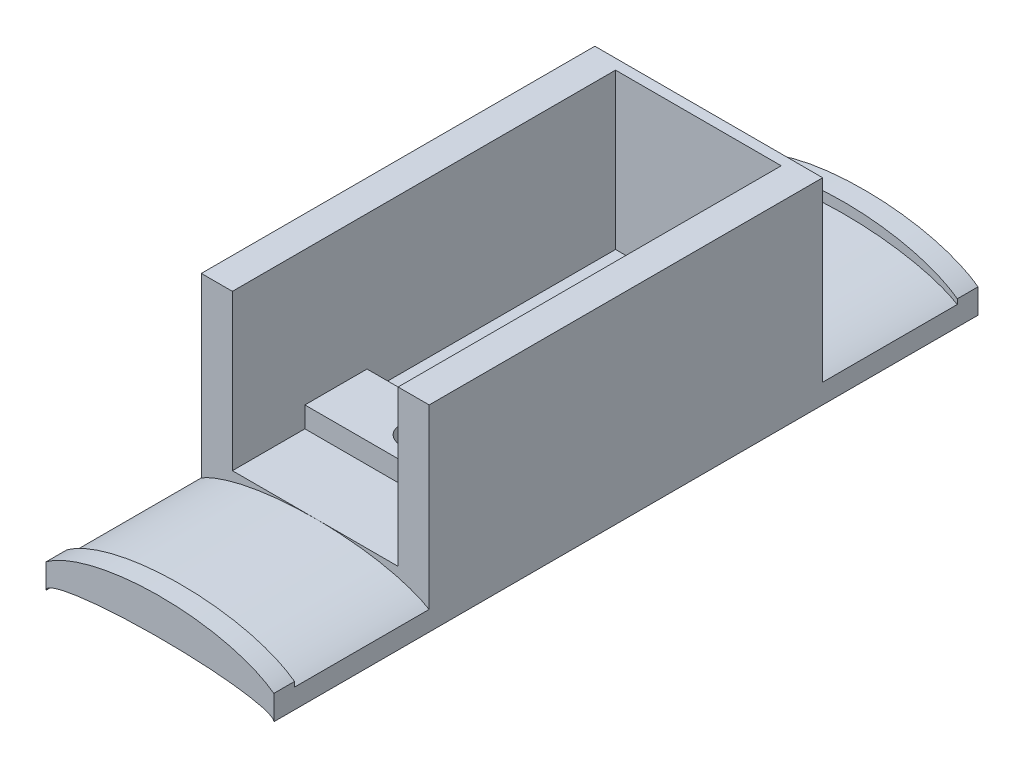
SolidWorks part; units mm, degrees
ref_plane "Front Plane" through (0, 0, 0) normal (0, 0, 1) x (1, 0, 0)
ref_plane "Top Plane" through (0, 0, 0) normal (0, 1, 0) x (1, 0, 0)
ref_plane "Right Plane" through (0, 0, 0) normal (1, 0, 0) x (0, 0, -1)
sketch "Sketch1" plane through (0, 0, 0) normal (0, 1, 0) x (1, 0, 0)
  line L1 (0, 0) -> (-22, 0)
  line L2 (0, 0) -> (0, 38)
  line L3 (0, 38) -> (-22, 38)
  line L4 (-22, 0) -> (-22, 38)
  dimension "D1" = 38
  dimension "D2" = 22
extrude "Boss-Extrude1" add sketch "Sketch1" along normal blind 4
sketch "Sketch2" plane through (0, 4, 0) normal (0, 1, 0) x (1, 0, 0)
  line L0 (-19, 0) -> (-19, 37)
  line L1 (-22, 0) -> (0, 0) construction
  line L2 (-19, 37) -> (-3, 37)
  line L3 (-3, 37) -> (-3, 0)
  line L4 (-3, 0) -> (0, 0)
  line L5 (0, 0) -> (0, 38)
  line L6 (0, 38) -> (-22, 38)
  line L7 (-22, 38) -> (-22, 0)
  line L8 (-22, 0) -> (-19, 0)
  dimension "D1" = 1
  dimension "D2" = 3
  dimension "D3" = 3
extrude "Boss-Extrude2" add sketch "Sketch2" along normal blind 15
sketch "Sketch3" plane through (0, 4, 0) normal (0, 1, 0) x (1, 0, 0)
  line L0 (-19, 0) -> (-3, 0) construction
  line L1 (-3, 37) -> (-3, 0) construction
  circle A0 centre (-11, 10) radius 1.75
  point P4 (-11, 0)
  dimension "D1" = 3.5
  dimension "D2" = 10
  dimension "D3" = 8
extrude "Cut-Extrude1" cut sketch "Sketch3" against normal through all
sketch "Sketch4" plane through (0, 4, 0) normal (0, 1, 0) x (1, 0, 0)
  line L0 (-19, 0) -> (-19, 37) construction
  line L1 (-19, 13) -> (-3, 13)
  line L2 (-19, 13) -> (-19, 7)
  line L3 (-19, 7) -> (-3, 7)
  line L4 (-3, 13) -> (-3, 7)
  line L5 (-3, 37) -> (-3, 0) construction
  line L6 (-19, 0) -> (-3, 0) construction
  line L7 (-11, 13) -> (-3, 13)
  line L8 (-11, 13) -> (-11, 28)
  line L9 (-11, 28) -> (-3, 28)
  line L10 (-3, 13) -> (-3, 28)
  dimension "D1" = 15
  dimension "D2" = 6
  dimension "D3" = 7
  dimension "D4" = 8
extrude "Boss-Extrude3" add sketch "Sketch4" along normal blind 2 contours L3 L1 M8 M6 M5 | L9 L8 L1 M6
sketch "Sketch5" plane through (0, 0, 0) normal (0, -1, 0) x (1, 0, 0)
  line L1 (-10.3005, -6.6072) -> (-13.5885, -7.6979)
  line L2 (-13.5885, -7.6979) -> (-14.2879, -11.0906)
  line L3 (-14.2879, -11.0906) -> (-11.6995, -13.3928)
  line L4 (-11.6995, -13.3928) -> (-8.4115, -12.3021)
  line L5 (-8.4115, -12.3021) -> (-7.7121, -8.9094)
  line L6 (-7.7121, -8.9094) -> (-10.3005, -6.6072)
  circle A0 centre (-11, -10) radius 3 construction
  point P0 (-11, -10)
  dimension "D1" = 6
extrude "Cut-Extrude2" cut sketch "Sketch5" against normal blind 3.5
sketch "Sketch6" plane through (0, 0, 0) normal (0, 0, 1) x (1, 0, 0)
  line L0 (-22, 0) -> (0, 0)
  ellipse E0 centre (-11, 0) end of major axis (0, 0) minor radius 1.5
  dimension "D1" = 3
extrude "Cut-Extrude3" cut sketch "Sketch6" against normal through all contours E0 M1
sketch "Sketch7" plane through (0, 19, 0) normal (0, 1, 0) x (1, 0, 0)
  line L0 (-22, 19) -> (0, 19)
  line L1 (-22, 38) -> (-22, 0) construction
  line L2 (0, 0) -> (0, 38) construction
sketch "Sketch8" plane through (0, 0, 0) normal (0, 0, 1) x (1, 0, 0)
  line L0 (-22, 0) -> (0, 0)
  line L1 (-22, 0) -> (-23.5, 0)
  line L2 (0, 0) -> (1.5, 0)
  ellipse E0 centre (-11, 0) end of major axis (-22, 0) minor radius 1.5
  ellipse E1 centre (-11, 0) end of major axis (0, 0) minor radius 1.5 (0, 0) -> (-22, 0) ccw construction
  ellipse E2 centre (-11, 0) end of major axis (0, 0) minor radius 1.5 (-10.3005, 1.497) -> (-13.5885, 1.4579) ccw construction
  ellipse E3 centre (-11, 0) end of major axis (1.5, 0) minor radius 4
  dimension "D1" = 8
  dimension "D2" = 25
extrude "Boss-Extrude4" add sketch "Sketch8" along normal blind 13 contours E3 M3 M1 M2
sketch "Sketch9" plane through (0, 0, -38) normal (0, 0, -1) x (-1, 0, 0)
  line L0 (0, 0) -> (22, 0)
  line L1 (-1.5, 0) -> (0, 0)
  line L2 (23.5, 0) -> (22, 0)
  ellipse E0 centre (11, 0) end of major axis (22, 0) minor radius 1.5
  ellipse E2 centre (11, 0) end of major axis (23.5, 0) minor radius 4
  dimension "D1" = 25
  dimension "D2" = 8
extrude "Boss-Extrude5" add sketch "Sketch9" along normal blind 13 contours E2 M4 M2 M3
sketch "Sketch11" plane through (0, 0, 13) normal (0, 0, 1) x (1, 0, 0)
  line L0 (-22, 0) -> (0, 0)
  line L1 (-23.5, 0) -> (1.5, 0)
  line L2 (-22, 0) -> (-22, 2.3749)
  line L3 (-22, 19) -> (-22, 1.8999) construction
  line L4 (0, 0) -> (0, 2.3749)
  line L5 (0, 19) -> (0, 1.8999) construction
  ellipse E0 centre (-11, 0) end of major axis (1.5, 0) minor radius 5
  ellipse E1 centre (-11, 0) end of major axis (-22, 0) minor radius 1.5
  ellipse E2 centre (-11, 0) end of major axis (0, 0) minor radius 1.5 (0, 0) -> (-22, 0) ccw construction
  dimension "D1" = 25
  dimension "D2" = 10
sketch "Sketch12" plane through (0, 0, -51) normal (0, 0, -1) x (-1, 0, 0)
  line L0 (-1.5, 0) -> (23.5, 0)
  line L1 (0, 0) -> (0, 2.3749)
  line L2 (22, 0) -> (22, 2.3749)
  ellipse E0 centre (11, 0) end of major axis (0, 0) minor radius 1.5
  ellipse E1 centre (11, 0) end of major axis (-1.5, 0) minor radius 5
extrude "Boss-Extrude6" add sketch "Sketch12" along normal blind 2 contours M4 M1 M2 M3 | L2 E1 L1 M2
extrude "Boss-Extrude7" add sketch "Sketch11" along normal blind 2 contours M4 M1 M2 M3 | L4 E0 L2 M2
